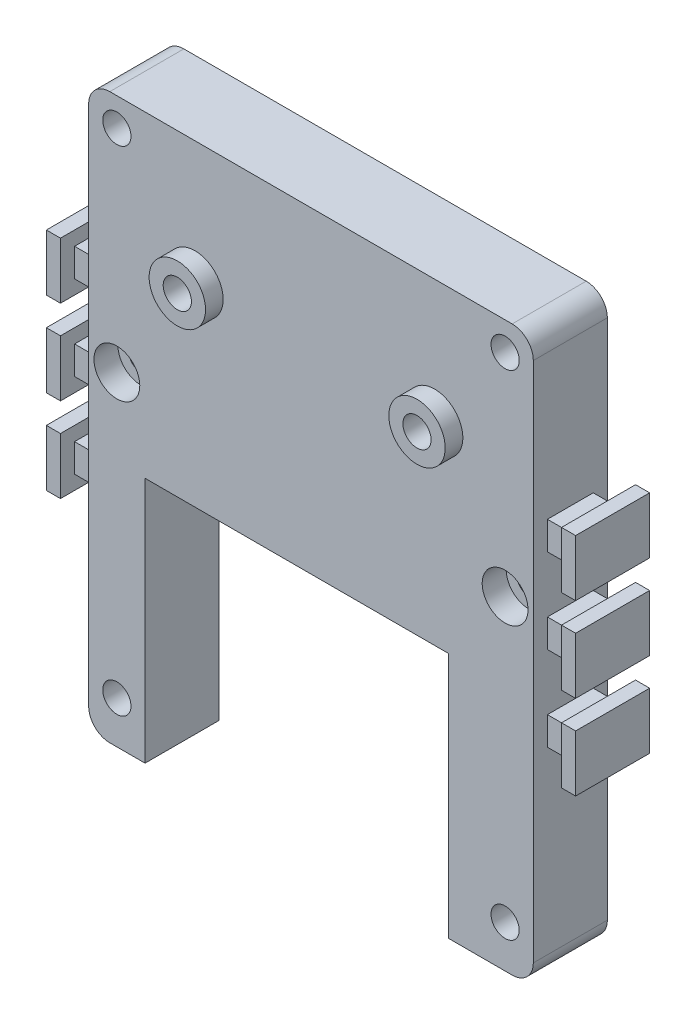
SolidWorks part; units mm, degrees
ref_plane "Ebene vorne" through (0, 0, 0) normal (0, 0, 1) x (1, 0, 0)
ref_plane "Ebene oben" through (0, 0, 0) normal (0, 1, 0) x (1, 0, 0)
ref_plane "Ebene rechts" through (0, 0, 0) normal (1, 0, 0) x (0, 0, -1)
sketch "Skizze1" plane through (0, 0, 0) normal (0, 0, 1) x (1, 0, 0)
  line L1 (-31.5375, -40) -> (31.5375, -40)
  line L2 (-31.5375, -40) -> (-31.5375, 40)
  line L3 (-31.5375, 40) -> (31.5375, 40)
  line L4 (31.5375, -40) -> (31.5375, 40)
  line L5 (-31.5375, -40) -> (31.5375, 40) construction
  line L6 (-31.5375, 40) -> (31.5375, -40) construction
  point P0 (0, 0)
  dimension "D1" = 80
  dimension "D2" = 63.075
extrude "Aufsatz-Linear austragen1" add sketch "Skizze1" along normal blind 10.5
sketch "Skizze2" plane through (0, 0, 0) normal (0, 0, -1) x (-1, 0, 0)
  line L0 (-19.5375, -40) -> (-19.5375, 10)
  line L1 (31.5375, -40) -> (-31.5375, -40) construction
  line L2 (23.5375, 10) -> (23.5375, -40)
  line L3 (23.5375, -40) -> (-19.5375, -40)
  line L4 (31.5375, 40) -> (31.5375, -40) construction
  line L5 (-31.5375, -40) -> (-31.5375, 40) construction
  arc A0 (-19.5375, 10) -> (23.5375, 10) centre (2, 10) cw
  dimension "D1" = 8
  dimension "D2" = 12
  dimension "D3" = 50
extrude "Schnitt-Linear austragen1" cut sketch "Skizze2" against normal blind 7
hole_wizard "Ø4.0 (4) Durchmesser Bohrung1" positions "Skizze3" profile "Skizze4" hole size "Ø4.0" standard "DIN"
sketch "Skizze3" plane through (0, 0, 0) normal (0, 0, -1) x (-1, 0, 0)
  line L0 (-31.5375, -40) -> (-31.5375, 40) construction
  line L1 (-31.5375, 40) -> (31.5375, 40) construction
  line L2 (31.5375, 40) -> (31.5375, -40) construction
  point P0 (-27.5375, 36)
  point P2 (27.5375, 36)
  point P4 (27.5375, -34)
  point P6 (-27.5375, -34)
  dimension "D1" = 4
  dimension "D2" = 4
  dimension "D3" = 70
  dimension "D4" = 4
sketch "Skizze4" plane through (27.5375, 36, 0) normal (1, 0, 0) x (0, 1, 0)
  line L0 (0, 0) -> (0, 10.5)
  line L1 (0, 10.5) -> (2, 10.5)
  line L2 (2, 10.5) -> (2, 0)
  line L5 (2, 0) -> (0, 0)
  line L11 (0, -6.35) -> (0, 107.95) construction
  dimension "Bohrerdurchmesser" = 4
  dimension "Bohrungstiefe" = 10.5
hole_wizard "Ø4.0 (4) Durchmesser Bohrung5" positions "Skizze6" profile "Skizze7" hole size "Ø4.0" standard "DIN"
sketch "Skizze6" plane through (0, 0, 10.5) normal (0, 0, 1) x (1, 0, 0)
  line L0 (31.5375, -40) -> (31.5375, 40) construction
  line L1 (31.5375, 40) -> (-31.5375, 40) construction
  point P0 (-16.4625, 22.5)
  point P2 (17.5375, 22.5)
  dimension "D1" = 34
  dimension "D3" = 14
  dimension "D4" = 17.5
sketch "Skizze7" plane through (-16.4625, 22.5, 10.5) normal (1, 0, 0) x (0, -1, 0)
  line L0 (0, 0) -> (0, 3.5)
  line L1 (0, 3.5) -> (2, 3.5)
  line L2 (2, 3.5) -> (2, 0)
  line L5 (2, 0) -> (0, 0)
  line L10 (0, 3.5) -> (-2, 3.5) construction
  line L11 (0, -6.35) -> (0, 107.95) construction
  dimension "Bohrerdurchmesser" = 4
  dimension "Bohrungstiefe" = 3.5
  dimension "Spitzenwinkel" = 180
sketch "Skizze8" plane through (0, 0, 10.5) normal (0, 0, 1) x (1, 0, 0)
  circle A0 centre (-16.4625, 22.5) radius 4
  circle A1 centre (17.5375, 22.5) radius 4
  circle A6 centre (17.5375, 22.5) radius 2 construction
  circle A7 centre (-16.4625, 22.5) radius 2 construction
  circle A10 centre (17.5375, 22.5) radius 2
  circle A11 centre (-16.4625, 22.5) radius 2
  dimension "D1" = 8
extrude "Aufsatz-Linear austragen2" add sketch "Skizze8" along normal blind 2.5
sketch "Skizze9" plane through (0, 0, 10.5) normal (0, 0, 1) x (1, 0, 0)
  line L0 (-31.5375, -40) -> (31.5375, -40) construction
  line L1 (-23.5375, -40) -> (19.5375, -40)
  line L2 (-23.5375, -40) -> (-23.5375, -5)
  line L3 (-23.5375, -5) -> (19.5375, -5)
  line L4 (19.5375, -40) -> (19.5375, -5)
  line L8 (-23.5375, -40) -> (-23.5375, 10) construction
  line L9 (19.5375, 10) -> (19.5375, -40) construction
  dimension "D3" = 35
extrude "Schnitt-Linear austragen2" cut sketch "Skizze9" against normal through all
sketch "Skizze10" plane through (0, 0, 10.5) normal (0, 0, 1) x (1, 0, 0)
  line L0 (-31.5375, 16.5) -> (-35.5375, 16.5)
  line L1 (-31.5375, 40) -> (-31.5375, -40) construction
  line L2 (-35.5375, 16.5) -> (-35.5375, 18.5)
  line L3 (-35.5375, 18.5) -> (-37.5375, 18.5)
  line L4 (-37.5375, 18.5) -> (-37.5375, 10.5)
  line L5 (-37.5375, 10.5) -> (-35.5375, 10.5)
  line L6 (-35.5375, 10.5) -> (-35.5375, 12.5)
  line L7 (-35.5375, 12.5) -> (-31.5375, 12.5)
  line L8 (-31.5375, 12.5) -> (-31.5375, 16.5)
  line L9 (31.5375, 16.5) -> (35.5375, 16.5)
  line L10 (31.5375, -40) -> (31.5375, 40) construction
  line L11 (35.5375, 16.5) -> (35.5375, 18.5)
  line L12 (35.5375, 18.5) -> (37.5375, 18.5)
  line L13 (37.5375, 18.5) -> (37.5375, 10.5)
  line L14 (37.5375, 10.5) -> (35.5375, 10.5)
  line L15 (35.5375, 10.5) -> (35.5375, 12.5)
  line L16 (35.5375, 12.5) -> (31.5375, 12.5)
  line L17 (31.5375, 12.5) -> (31.5375, 16.5)
  line L18 (31.5375, 40) -> (-31.5375, 40) construction
  point P14 (-31.5375, 14.5)
  dimension "D1" = 4
  dimension "D2" = 2
  dimension "D3" = 4
  dimension "D4" = 8
  dimension "D5" = 25.5
extrude "Aufsatz-Linear austragen3" add sketch "Skizze10" against normal up to surface (10.5 mm away)
pattern_linear "Lineares Muster1" count 3 spacing 12 along (0, -1, 0) of "Aufsatz-Linear austragen3"
fillet "Verrundung1" radius 3 4 edges at (-31.5375, -40, 5.25) (31.5375, -40, 5.25) (-31.5375, 40, 5.25) (31.5375, 40, 5.25)
hole_wizard "Stirnsenkung für M3 Zylinderschraube mit Innensechskant1" positions "Skizze11" profile "Skizze12" counterbore size "M3" standard "DIN"
sketch "Skizze11" plane through (0, 0, 10.5) normal (0, 0, 1) x (1, 0, 0)
  line L0 (-27.5375, 6) -> (-27.5375, 36) construction
  line L2 (27.5375, 36) -> (27.5375, 6) construction
  point P0 (-27.5375, 6)
  point P2 (27.5375, 6)
  dimension "D1" = 30
sketch "Skizze12" plane through (-27.5375, 6, 10.5) normal (1, 0, 0) x (0, -1, 0)
  line L0 (0, 0) -> (0, 10.5)
  line L1 (0, 10.5) -> (1.7, 10.5)
  line L3 (1.7, 10.5) -> (1.7, 3.4)
  line L4 (1.7, 3.4) -> (3.25, 3.4)
  line L5 (3.25, 3.4) -> (3.25, 0)
  line L7 (3.25, 0) -> (0, 0)
  line L11 (0, -6.35) -> (0, 107.95) construction
  dimension "Bohrerdurchmesser" = 3.4
  dimension "Bohrungstiefe" = 10.5
  dimension "Senkdurchmesser2" = 6.5
  dimension "Senktiefe2" = 3.4
sketch "Skizze13" plane through (0, 16.5, 0) normal (0, 1, 0) x (1, 0, 0)
  line L0 (-31.5375, 0) -> (-31.5375, -10.5) construction
  line L1 (-35.5375, 0) -> (-31.5375, 0)
  line L2 (-35.5375, 0) -> (-35.5375, -2)
  line L3 (-35.5375, -2) -> (-31.5375, -2)
  line L4 (-31.5375, 0) -> (-31.5375, -2)
  line L5 (35.5375, 0) -> (35.5375, -10.5) construction
  line L6 (-35.5375, -10.5) -> (-31.5375, -10.5)
  line L7 (-35.5375, -10.5) -> (-35.5375, -8.5)
  line L8 (-35.5375, -8.5) -> (-31.5375, -8.5)
  line L9 (-31.5375, -10.5) -> (-31.5375, -8.5)
  line L10 (31.5375, 0) -> (35.5375, 0)
  line L11 (31.5375, 0) -> (31.5375, -2)
  line L12 (31.5375, -2) -> (35.5375, -2)
  line L13 (35.5375, 0) -> (35.5375, -2)
  line L14 (31.5375, 0) -> (31.5375, -10.5) construction
  line L15 (35.5375, -10.5) -> (31.5375, -10.5)
  line L16 (35.5375, -10.5) -> (35.5375, -8.5)
  line L17 (35.5375, -8.5) -> (31.5375, -8.5)
  line L18 (31.5375, -10.5) -> (31.5375, -8.5)
  dimension "D1" = 2
extrude "Schnitt-Linear austragen3" cut sketch "Skizze13" against normal through all
